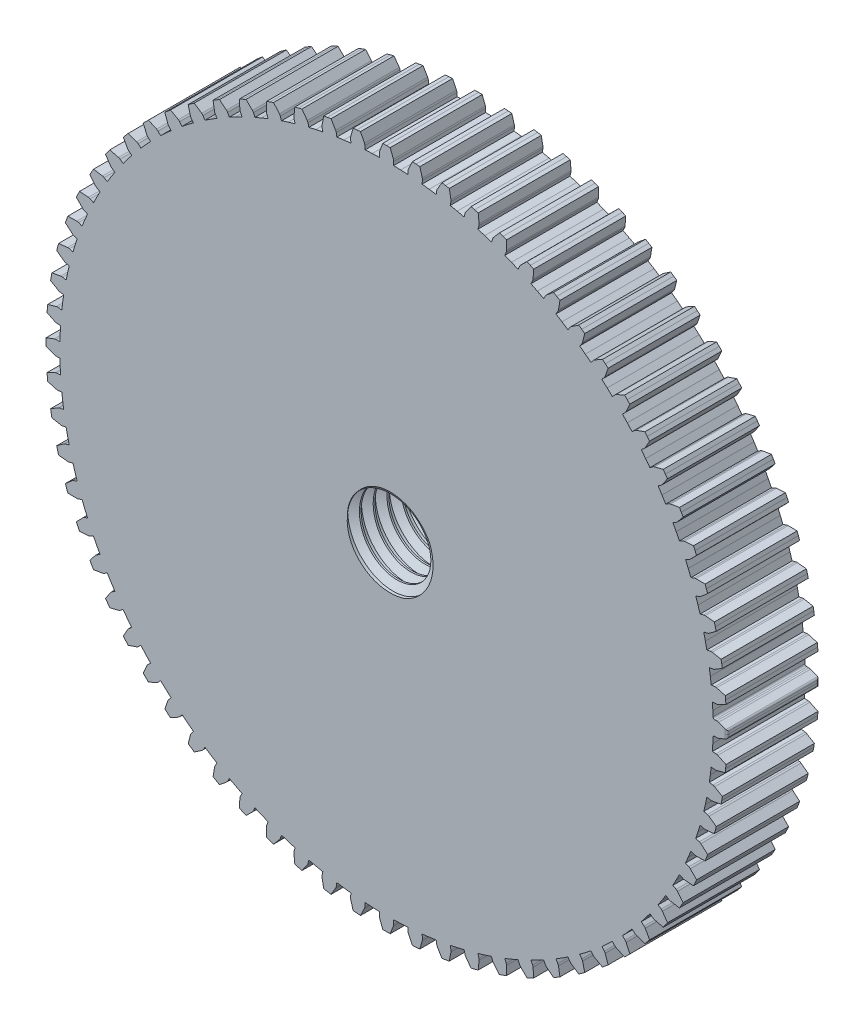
SolidWorks part; units mm, degrees
ref_plane "Front Plane" through (0, 0, 0) normal (0, 0, 1) x (1, 0, 0)
ref_plane "Top Plane" through (0, 0, 0) normal (0, 1, 0) x (1, 0, 0)
ref_plane "Right Plane" through (0, 0, 0) normal (1, 0, 0) x (0, 0, -1)
imported_body "Gear22-1-solid1"
imported_body "Gear12-1-solid1"
sketch "Esquisse15" plane through (0, 0, 9.5894) normal (0, 0, -1) x (-1, 0, 0)
  circle A0 centre (0, 0) radius 4.25 construction
  circle A1 centre (0, 0) radius 4.25
extrude "Boss.-Extru.1" add sketch "Esquisse15" along normal through all
sketch "Esquisse16" plane through (0, 0, 9.5894) normal (0, 0, 1) x (1, 0, 0)
  circle A1 centre (0, 0) radius 4.25
  circle A2 centre (0, 0) radius 4.25
  dimension "D1" = 0
extrude "Boss.-Extru.3" add sketch "Esquisse16" along normal through all
sketch "Esquisse18" plane through (0, 0, 0) normal (0, 0, -1) x (-1, 0, 0)
  circle A0 centre (0, 0) radius 4.25
  dimension "D1" = 8.5
extrude "Enlèv. mat.-Extru.4" cut sketch "Esquisse18" against normal blind 23
sketch "Esquisse20" plane through (0, 0, 0) normal (0, 0, -1) x (-1, 0, 0)
  circle A0 centre (0, 0) radius 10.5
  dimension "D1" = 21
extrude "Enlèv. mat.-Extru.5" cut sketch "Esquisse20" against normal blind 20
sketch "Esquisse22" plane through (0, 0, 0) normal (0, 0, 1) x (1, 0, 0)
  circle A0 centre (0, 0) radius 10.5
  dimension "D1" = 21
extrude "Boss.-Extru.4" add sketch "Esquisse22" along normal through all
sketch "Esquisse23" plane through (0, 0, 0) normal (0, 0, 1) x (1, 0, 0)
  circle A0 centre (0, 0) radius 4.25
  dimension "D1" = 8.5
extrude "Enlèv. mat.-Extru.6" cut sketch "Esquisse23" along normal through all
thread "Filetage1" pitch 1.5 start angle 0, offset 3, length 20, pitch 1.5, diameter 8.5
ref_plane "Plan1" through (-4.25, 0, 13) normal (0, -1, 0) x (-1, 0, 0)
sketch "Profil de filetage1" plane through (-4.25, 0, 13) normal (0, -1, 0) x (-1, 0, 0)
  line L0 (0, 0) -> (0, 1.5) construction
  line L11 (0, 1.3125) -> (0, 0)
  line L12 (0, 0) -> (0.8119, 0.4688)
  line L13 (0.8119, 0.4688) -> (0.8119, 0.8438)
  line L15 (0.8119, 0.8438) -> (0, 1.3125)
  line L17 (0.8119, 0.6563) -> (0, 0.6563) construction
  point P3 (0, 0)
  dimension "Pitch" = 1.5
  dimension "Profile_Angle" = 60
  dimension "Profile_Land" = 0.375
  dimension "Profile_Height" = 0.8119
